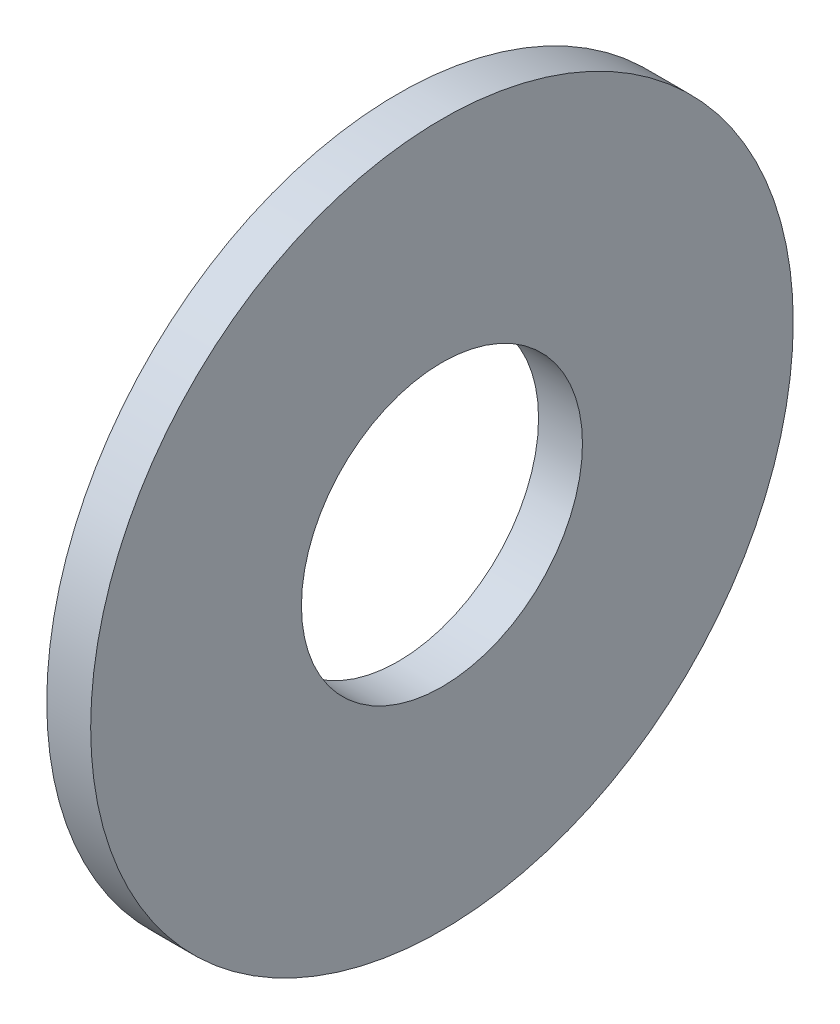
SolidWorks part; units mm, degrees
ref_plane "Plane1" through (0, 0, 0) normal (0, 0, 1) x (1, 0, 0)
ref_plane "Plane2" through (0, 0, 0) normal (0, 1, 0) x (1, 0, 0)
ref_plane "Plane3" through (0, 0, 0) normal (1, 0, 0) x (0, 0, -1)
sketch "Sketch1" plane through (0, 0, 0) normal (1, 0, 0) x (0, 0, -1)
  circle A0 centre (0, 0) radius 1.6
  circle A1 centre (0, 0) radius 4
  dimension "InsideDia" = 3.2
  dimension "OutsideDia" = 8
extrude "Base-Extrude" add sketch "Sketch1" along normal blind 0.5
